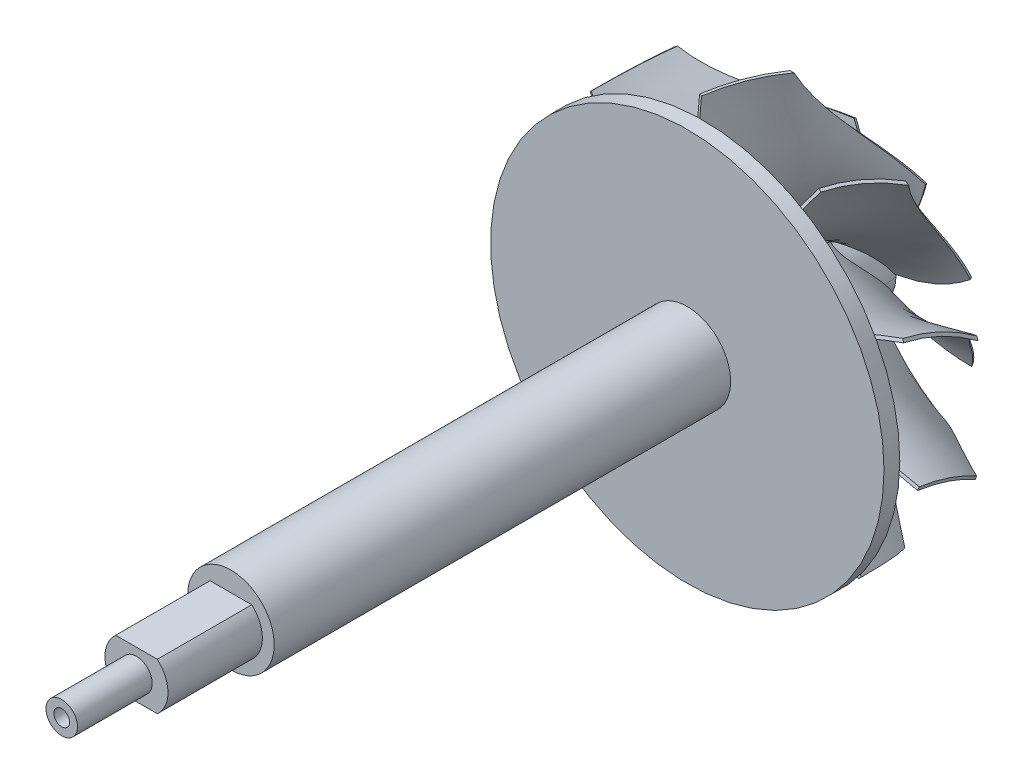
SolidWorks part; units mm, degrees
ref_plane "Front Plane" through (0, 0, 0) normal (0, 0, 1) x (1, 0, 0)
ref_plane "Top Plane" through (0, 0, 0) normal (0, 1, 0) x (1, 0, 0)
ref_plane "Right Plane" through (0, 0, 0) normal (1, 0, 0) x (0, 0, -1)
sketch "Sketch1" plane through (0, 0, 0) normal (0, 0, 1) x (1, 0, 0)
  circle A0 centre (0, 0) radius 25
  dimension "D1" = 50
extrude "Boss-Extrude1" add sketch "Sketch1" along normal blind 2
sketch "Sketch2" plane through (0, 0, 0) normal (0, 1, 0) x (1, 0, 0)
  line L0 (0, 0) -> (0, 21)
  line L1 (25, 0) -> (-25, 0) construction
  line L2 (0, 21) -> (-1, 21)
  line L3 (-1, 21) -> (-1, 20)
  line L4 (-1, 20) -> (-4.5, 20)
  line L5 (0, 0) -> (-16, 0)
  line L6 (-16, 0) -> (-16, 1)
  line L7 (-16, 1) -> (-12, 1)
  arc A0 (-12, 1) -> (-4.5, 20) centre (-40.3597, 23.1749) ccw
  dimension "D6" = 36
  dimension "D1" = 21
  dimension "D2" = 1
  dimension "D3" = 1
  dimension "D4" = 4.5
  dimension "D5" = 1
  dimension "D7" = 16
  dimension "D8" = 12
revolve "Revolve1" add sketch "Sketch2" angle 360 about L0
sketch "Sketch3" plane through (0, 0, 0) normal (0, 1, 0) x (1, 0, 0)
  line L0 (25, 0) -> (-25, 0) construction
  line L1 (4.5, 20) -> (-4.5, 20) construction
  line L2 (-0.1165, 20.1626) -> (0.1165, 19.8374)
  line L3 (-8.2036, 0) -> (-7.7964, 0)
  arc A0 (-8, 0) -> (0, 20) centre (11.647, 3.7412) cw construction
  arc A1 (-7.7964, 0) -> (0.1165, 19.8374) centre (11.647, 3.7412) cw
  arc A2 (-8.2036, 0) -> (-0.1165, 20.1626) centre (11.647, 3.7412) cw
  arc A3 (-7.8035, 0.0374) -> (0.1165, 19.8374) centre (11.647, 3.7412) cw construction
  arc A4 (-8.1965, -0.0374) -> (-0.1165, 20.1626) centre (11.647, 3.7412) cw construction
  dimension "D1" = 20
  dimension "D2" = 8
  dimension "D3" = 0.2
  dimension "D4" = 0.2
sketch "Sketch4" plane through (0, 0, 0) normal (0, 0, -1) x (-1, 0, 0)
  line L0 (0, 2.9553) -> (0, -2.9589) construction
  spline S0 degree 3 poles (0, 0) (0, 3.7709) (1.3329, 12.9735) (9.038, 19.3486) (12, 24) knots 0 0 0 0 0.388836 1 1 1 1
  dimension "D1" = 10.5
  dimension "D2" = 20
  dimension "D3" = 24
  dimension "D4" = 2
  dimension "D5" = 9
  dimension "D6" = 12
sweep "Sweep1" add profiles "Sketch3" path "Sketch4" parameters "D1"=22
sketch "Sketch5" plane through (0, 0, 0) normal (0, 1, 0) x (1, 0, 0)
  line L0 (25, 0) -> (35, 0)
  line L1 (35, 0) -> (35, 21)
  line L2 (35, 21) -> (14.5, 21)
  line L3 (25, 0) -> (25, 11)
  line L4 (0, 0) -> (0, 32.2665) construction
  arc A0 (14.5, 21) -> (25, 11) centre (34.0749, 31.0411) ccw
  dimension "D4" = 22
  dimension "D1" = 11
  dimension "D2" = 21
  dimension "D3" = 35
  dimension "D5" = 14.5
revolve "Cut-Revolve1" cut sketch "Sketch5" angle 360 about L4
pattern_circular "CirPattern1" count 10 over 360 about axis through (0, 0, 2) along (0, 0, -1) of "Cut-Revolve1", "Sweep1"
sketch "Sketch6" plane through (0, 0, 0) normal (0, 1, 0) x (1, 0, 0)
  line L0 (0, -2) -> (0, -81.5)
  line L1 (-25, -2) -> (25, -2) construction
  line L2 (0, -81.5) -> (2, -81.5)
  line L3 (2, -81.5) -> (2, -72)
  line L4 (2, -72) -> (4, -72)
  line L5 (4, -72) -> (4, -60)
  line L6 (4, -60) -> (5.5, -60)
  line L7 (5.5, -60) -> (5.5, -2)
  line L8 (5.5, -2) -> (0, -2)
  dimension "D1" = 2
  dimension "D2" = 4
  dimension "D3" = 5.5
  dimension "D4" = 9.5
  dimension "D5" = 12
  dimension "D6" = 58
revolve "Revolve2" add sketch "Sketch6" angle 360 about L0
sketch "Sketch7" plane through (0, 0, 72) normal (0, 0, 1) x (1, 0, 0)
  line L0 (0, 0) -> (6.5554, 0) construction
  line L1 (-6.1488, 6.4852) -> (6.5554, 6.4852)
  line L2 (-6.1488, 6.4852) -> (-6.1488, 3)
  line L3 (-6.1488, 3) -> (6.5554, 3)
  line L4 (6.5554, 6.4852) -> (6.5554, 3)
  line L5 (6.5554, -6.4852) -> (6.5554, -3)
  line L6 (-6.1488, -3) -> (6.5554, -3)
  line L7 (-6.1488, -6.4852) -> (-6.1488, -3)
  line L8 (-6.1488, -6.4852) -> (6.5554, -6.4852)
  dimension "D1" = 3
extrude "Cut-Extrude1" cut sketch "Sketch7" against normal up to surface (12 mm away)
hole_wizard "Ø2.0 (2) Diameter Hole1" positions "Sketch9" profile "Sketch8" hole size "Ø2.0" standard "DIN"
sketch "Sketch9" plane through (0, 0, 81.5) normal (0, 0, 1) x (1, 0, 0)
  point P0 (0, 0)
sketch "Sketch8" plane through (0, 0, 81.5) normal (1, 0, 0) x (0, -1, 0)
  line L0 (0, 0) -> (0, 10.6009)
  line L1 (0, 10.6009) -> (1, 10)
  line L2 (1, 10) -> (1, 0)
  line L5 (1, 0) -> (0, 0)
  line L10 (0, 10.6009) -> (-1, 10) construction
  line L11 (0, -6.35) -> (0, 107.95) construction
  dimension "Hole Dia." = 2
  dimension "Hole Depth" = 10
  dimension "Drill Angle" = 118
